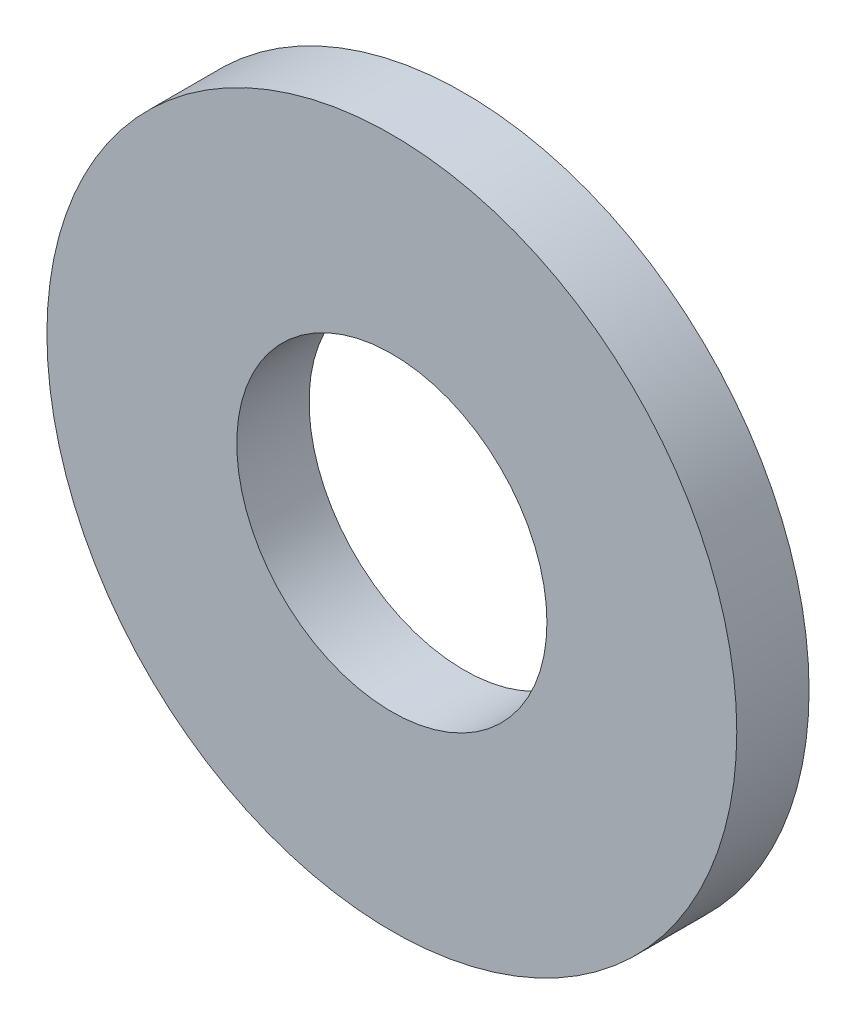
SolidWorks part; units mm, degrees
ref_plane "Front Plane" through (0, 0, 0) normal (0, 0, 1) x (1, 0, 0)
ref_plane "Top Plane" through (0, 0, 0) normal (0, 1, 0) x (1, 0, 0)
ref_plane "Right Plane" through (0, 0, 0) normal (1, 0, 0) x (0, 0, -1)
sketch "Sketch1" plane through (0, 0, 0) normal (0, 0, 1) x (1, 0, 0)
  line L0 (0, 0) -> (2.5235, -2.5235) construction
  line L1 (-3.5687, 0) -> (3.5687, 0)
  line L2 (-7.9375, 0) -> (7.9375, 0) construction
  circle A0 centre (0, 0) radius 3.5687 construction
  circle A1 centre (0, 0) radius 7.9375 construction
  circle A2 centre (0, 0) radius 3.175 construction
  point P0 (0, 0)
  point P7 (2.5235, -2.5235)
  dimension "D1" = 45
  dimension "ID" = 7.1374
  dimension "OD" = 15.875
  dimension "For Screw Size" = 6.35
sketch "Sketch2" plane through (0, 0, 0) normal (1, 0, 0) x (0, 0, -1)
  line L0 (0, 7.9375) -> (0, -7.9375) construction
  line L1 (-0.8318, -7.9375) -> (0.8319, -7.9375) construction
  line L2 (-0.8318, -7.9375) -> (-0.8319, 7.9375) construction
  line L3 (-0.8319, 7.9375) -> (0.8319, 7.9375) construction
  line L4 (0.8319, -7.9375) -> (0.8319, 7.9375) construction
  line L5 (0, 7.9375) -> (0, -7.9375) construction
  line L6 (-0.8318, 0) -> (0.8318, 0) construction
  point P0 (0, 0)
  dimension "Thickness" = 1.6637
sketch "Sketch3" plane through (0, 0, 0) normal (0, 0, 1) x (1, 0, 0)
  circle A0 centre (0, 0) radius 7.9375 construction
  circle A1 centre (0, 0) radius 3.5687 construction
  circle A2 centre (0, 0) radius 7.9375
  circle A3 centre (0, 0) radius 3.5687
extrude "Boss-Extrude1" add sketch "Sketch3" along normal up to vertex (0.8318 mm away) and the other way up to vertex (0.8318 mm away)
